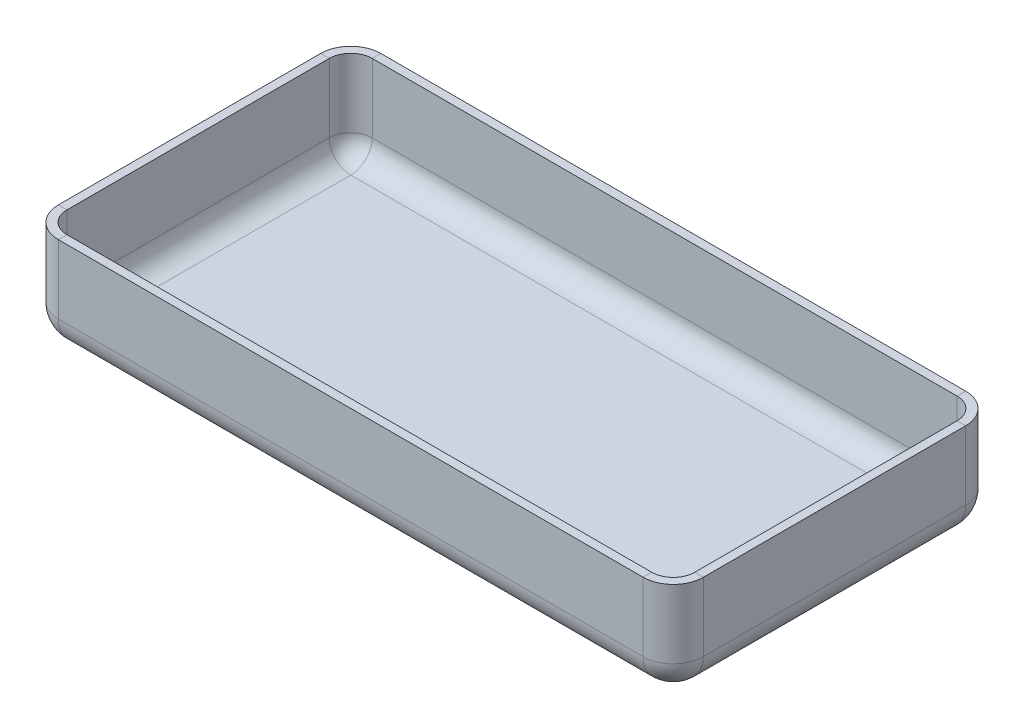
SolidWorks part; units mm, degrees
ref_plane "Front Plane" through (0, 0, 0) normal (0, 0, 1) x (1, 0, 0)
ref_plane "Top Plane" through (0, 0, 0) normal (0, 1, 0) x (1, 0, 0)
ref_plane "Right Plane" through (0, 0, 0) normal (1, 0, 0) x (0, 0, -1)
sketch "Sketch1" plane through (0, 0, 0) normal (0, 1, 0) x (1, 0, 0)
  line L1 (0, 0) -> (150, 0)
  line L2 (0, 0) -> (0, 75)
  line L3 (0, 75) -> (150, 75)
  line L4 (150, 0) -> (150, 75)
  dimension "D1" = 150
  dimension "D2" = 75
extrude "Extrude1" add sketch "Sketch1" along normal blind 30
fillet "Fillet1" radius 7 12 edges at (0, 15, 0) (150, 15, 0) (150, 15, -75) (0, 15, -75) (75, 30, -75) (150, 30, -37.5) (75, 30, 0) (0, 30, -37.5) (75, 0, 0) (150, 0, -37.5) (75, 0, -75) (0, 0, -37.5)
shell "Shell1" thickness 2
